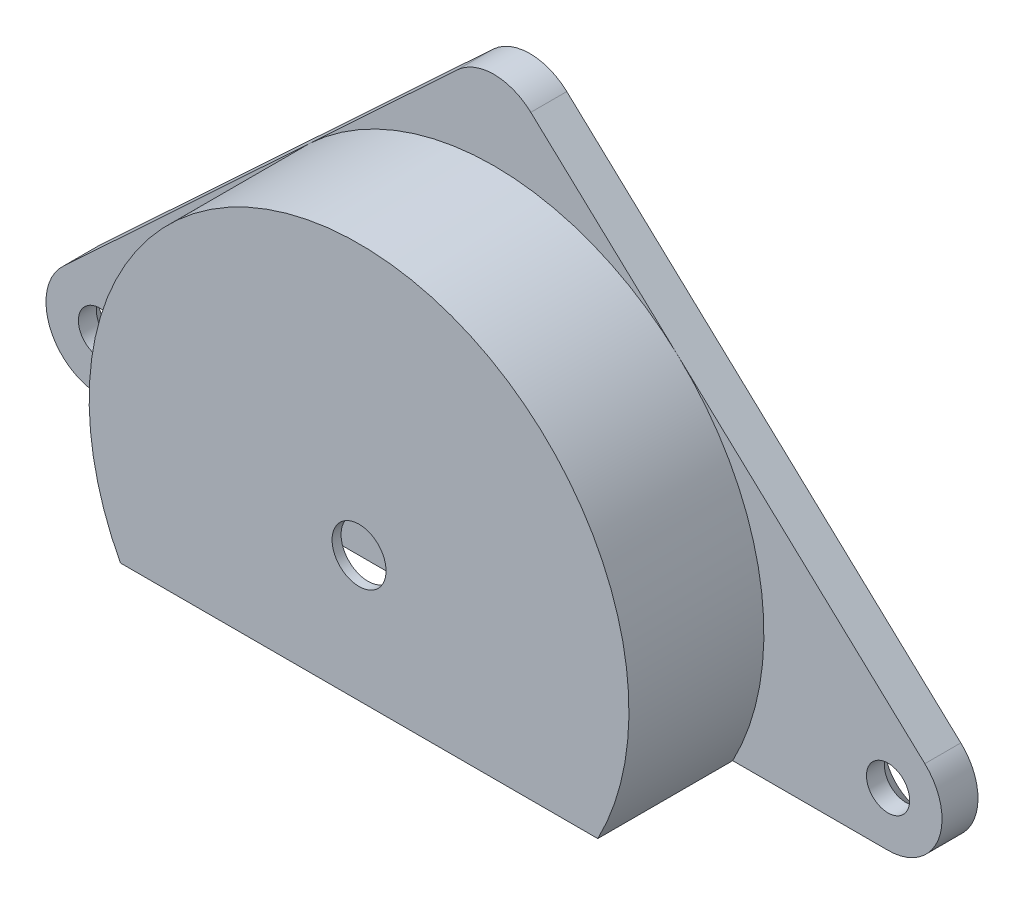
SolidWorks part; units mm, degrees
ref_plane "Front Plane" through (0, 0, 0) normal (0, 0, 1) x (1, 0, 0)
ref_plane "Top Plane" through (0, 0, 0) normal (0, 1, 0) x (1, 0, 0)
ref_plane "Right Plane" through (0, 0, 0) normal (1, 0, 0) x (0, 0, -1)
sketch "Sketch1" plane through (0, 0, 0) normal (0, 0, 1) x (1, 0, 0)
  circle A0 centre (0, 0) radius 15
  dimension "D1" = 30
extrude "Boss-Extrude1" add sketch "Sketch1" along normal mid plane 7.5
sketch "Sketch2" plane through (0, 0, 3.75) normal (0, 0, 1) x (1, 0, 0)
  line L0 (-13.2665, -7) -> (13.2665, -7)
  circle A0 centre (0, 0) radius 15 construction
  arc A1 (-13.2665, -7) -> (13.2665, -7) centre (0, 0) ccw
  point P4 (0, 0)
  dimension "D1" = 7
extrude "Cut-Extrude1" cut sketch "Sketch2" against normal blind 7.5
shell "Shell1" thickness 0.5
sketch "Sketch3" plane through (0, 0, -3.75) normal (0, 0, -1) x (-1, 0, 0)
  line L0 (-29.5208, -7) -> (29.5208, -7)
  line L2 (-29.5208, -7) -> (0, 20.5)
  line L3 (0, 20.5) -> (29.5208, -7)
  line L4 (-13.2665, -7) -> (13.2665, -7) construction
  arc A0 (13.2665, -7) -> (-13.2665, -7) centre (0, 0) ccw construction
  point P3 (0, -7)
  dimension "D1" = 27.5
extrude "Boss-Extrude2" add sketch "Sketch3" along normal blind 2
fillet "Fillet1" radius 3 3 edges at (0, 20.5, -4.75) (-29.5208, -7, -4.75) (29.5208, -7, -4.75)
hole_wizard "CSK for M2 Countersunk Flat Head Screw1" positions "Sketch7" profile "Sketch8" countersink size "M2" standard "ISO"
sketch "Sketch7" plane through (0, 0, -5.75) normal (0, 0, -1) x (-1, 0, 0)
  point P0 (-21.8991, -4)
  point P3 (21.8991, -4)
sketch "Sketch8" plane through (21.8991, -4, -5.75) normal (1, 0, 0) x (0, 1, 0)
  line L0 (0, 0) -> (0, 2)
  line L1 (0, 2) -> (1.2, 2)
  line L2 (1.2, 2) -> (1.2, 1)
  line L3 (1.2, 1) -> (2.2, 0)
  line L5 (2.2, 0) -> (0, 0)
  line L6 (-1.2, 1) -> (-2.2, 0) construction
  line L11 (0, -6.35) -> (0, 107.95) construction
  dimension "Thru Hole Dia." = 2.4
  dimension "Thru Hole Depth" = 2
  dimension "Near C'Sink Dia." = 4.4
  dimension "Near C'Sink Angle" = 90
sketch "Sketch9" plane through (0, 0, 3.75) normal (0, 0, 1) x (1, 0, 0)
  circle A0 centre (0, 0) radius 1.5
  dimension "D1" = 3
extrude "Cut-Extrude2" cut sketch "Sketch9" against normal through all
sketch "Sketch10" plane through (0, 0, -3.75) normal (0, 0, 1) x (1, 0, 0)
  line L0 (-21.3196, -2.9492) -> (-21.8991, -4)
  circle A0 centre (-21.8991, -4) radius 1.2 construction
